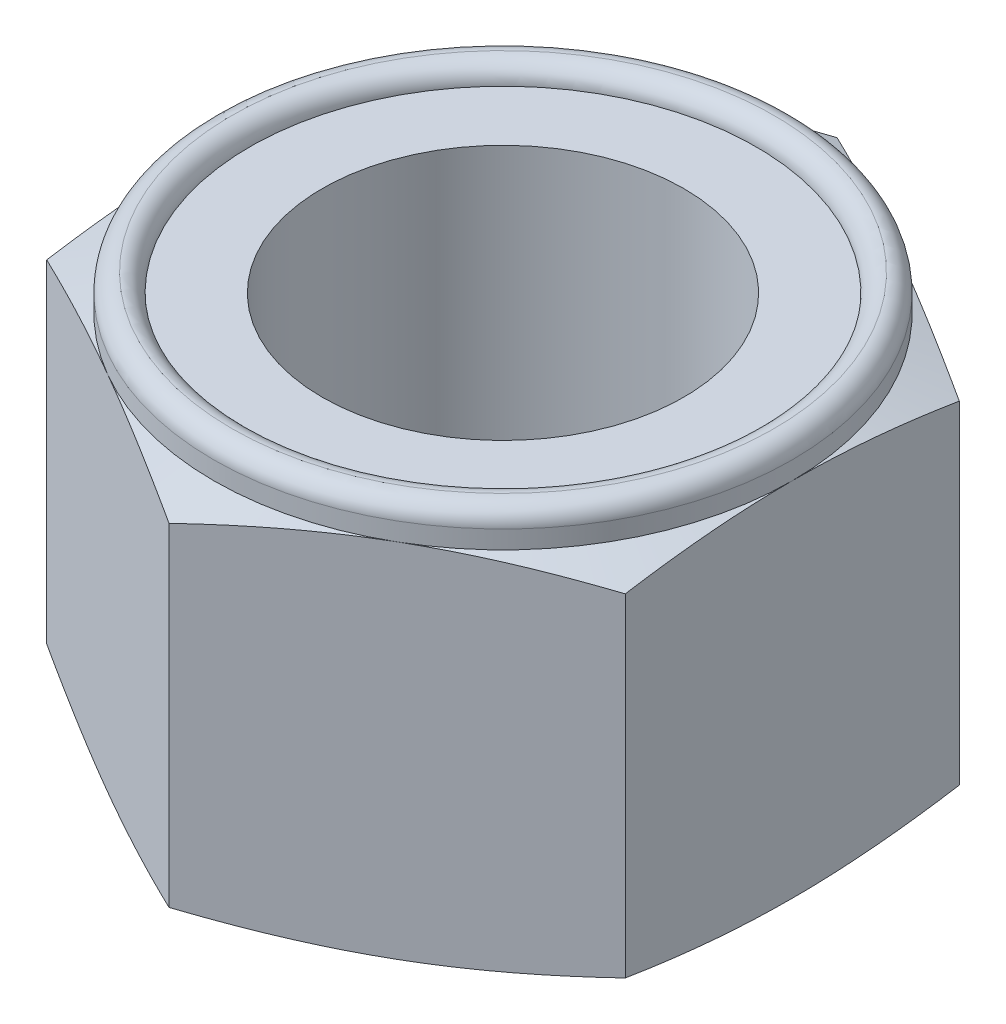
SolidWorks part; units mm, degrees
ref_plane "Front Plane" through (0, 0, 0) normal (0, 0, 1) x (1, 0, 0)
ref_plane "Top Plane" through (0, 0, 0) normal (0, 1, 0) x (1, 0, 0)
ref_plane "Right Plane" through (0, 0, 0) normal (1, 0, 0) x (0, 0, -1)
sketch "Sketch1" plane through (0, 0, 0) normal (0, 1, 0) x (1, 0, 0)
  line L1 (0, 7.3323) -> (-6.35, 3.6662)
  line L2 (-6.35, 3.6662) -> (-6.35, -3.6662)
  line L3 (-6.35, -3.6662) -> (0, -7.3323)
  line L4 (0, -7.3323) -> (6.35, -3.6662)
  line L5 (6.35, -3.6662) -> (6.35, 3.6662)
  line L6 (6.35, 3.6662) -> (0, 7.3323)
  circle A0 centre (0, 0) radius 6.35 construction
  dimension "Width Across Flats" = 12.7
extrude "Extrude1" add sketch "Sketch1" along normal blind 7.9375
sketch "Sketch2" plane through (0, 7.9375, 0) normal (0, 1, 0) x (-1, 0, 0)
  circle A0 centre (0, 0) radius 6.35
  dimension "V" = 12.7
extrude "Extrude2" add sketch "Sketch2" along normal blind 0.7937
sketch "Sketch3" plane through (0, 8.7312, 0) normal (0, 1, 0) x (-1, 0, 0)
  circle A0 centre (0, 0) radius 3.9688
  dimension "Thread" = 7.9375
extrude "Cut-Extrude1" cut sketch "Sketch3" against normal through all
ref_plane "Plane1" through (0, 0, 0) normal (1, 0, 0) x (0, 0, -1)
sketch "Sketch4" plane through (0, 0, 0) normal (1, 0, 0) x (0, 0, -1)
  line L0 (-7.3323, 7.9375) -> (-6.35, 7.9375)
  line L1 (-7.3323, 7.9375) -> (-7.3323, 7.62)
  line L2 (-7.3323, 7.9375) -> (-7.3323, 0) construction
  line L3 (-7.3323, 7.62) -> (-6.35, 7.9375)
  line L4 (-7.3323, 0) -> (-6.35, 0)
  line L5 (-7.3323, 0) -> (-3.6662, 0) construction
  line L6 (-6.35, 0) -> (-7.3323, 0.3175)
  line L7 (-7.3323, 0.3175) -> (-7.3323, 0)
  dimension "Cut" = 0.3175
revolve "Cut-Revolve1" cut sketch "Sketch4" angle 360 about axis through (0, 0, 0) along (0, 1, 0)
sketch "Sketch5" plane through (0, 8.7312, 0) normal (0, 1, 0) x (-1, 0, 0)
  circle A0 centre (0, 0) radius 5.5562
  dimension "1/16" = 11.1125
extrude "Cut-Extrude2" cut sketch "Sketch5" against normal blind 0.3969
fillet "Fillet1" radius 0.3969 1 edges at (0, 8.7312, 6.35)
fillet "Fillet2" radius 0.3969 1 edges at (0, 8.7312, 5.5562)
